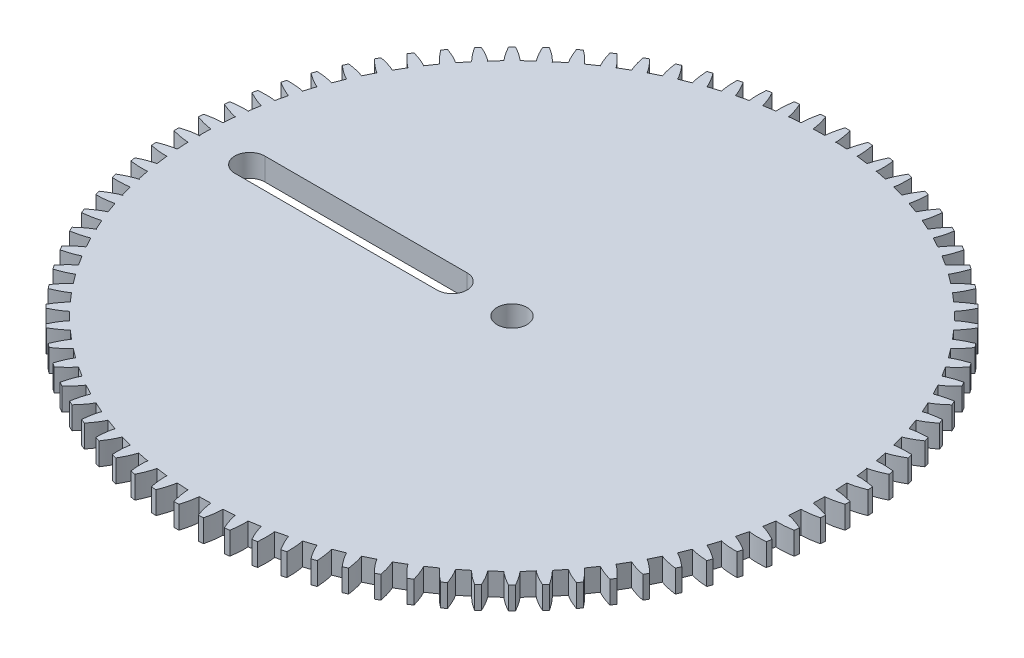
SolidWorks part; units mm, degrees
ref_plane "Front Plane" through (0, 0, 0) normal (0, 0, 1) x (1, 0, 0)
ref_plane "Top Plane" through (0, 0, 0) normal (0, 1, 0) x (1, 0, 0)
ref_plane "Right Plane" through (0, 0, 0) normal (1, 0, 0) x (0, 0, -1)
sketch "Sketch1" plane through (0, 0, 0) normal (0, 1, 0) x (1, 0, 0)
  line L0 (0, 0) -> (0, 20.8152) construction
  line L1 (0, 0) -> (-20.8152, 0) construction
  line L2 (0, 0) -> (-21.9963, -0.4018) construction
  line L3 (0, 0) -> (-20.8013, -0.7602) construction
  line L4 (0, 0) -> (-20.7596, -1.5194) construction
  circle A0 centre (0, 0) radius 21.5 construction
  circle A1 centre (0, 0) radius 20.8152 construction
  circle A2 centre (0, 0) radius 20.875 construction
  circle A3 centre (0, 0) radius 22 construction
  spline S0 degree 4 poles (-20.8152, 0) (-20.8518, 0) (-20.9546, -0.0038) (-21.1481, -0.0258) (-21.4608, -0.0826) (-21.8534, -0.1856) (-22.3513, -0.3531) (-22.9232, -0.5936) (-23.5332, -0.9024) (-24.1739, -1.2842) (-24.7904, -1.7051) (-25.3824, -2.1598) (-25.9498, -2.6446) (-26.6091, -3.2656) (-27.3591, -4.06) (-28.1717, -5.0485) (-29.0143, -6.2484) (-29.7821, -7.5292) (-30.4617, -8.8588) (-30.9809, -10.0577) (-31.3734, -11.1061) (-31.6662, -11.9916) (-31.88, -12.7065) (-32.1223, -13.6072) (-32.3314, -14.5163) (-32.4906, -15.3406) (-32.6098, -16.0771) (-32.6899, -16.631) (-32.7605, -17.1859) (-32.8196, -17.7428) (-32.8673, -18.2996) (-32.8995, -18.7666) (-32.9205, -19.1302) (-32.9416, -19.6109) (-32.9531, -19.9952) (-32.9652, -20.6867) (-32.958, -21.1945) (-32.9494, -21.7453) (-32.9362, -22.0017) (-32.9302, -22.1799) knots 0 0 0 0 0 0.005377 0.015084 0.028532 0.04661 0.064855 0.092111 0.119476 0.146842 0.174209 0.201575 0.228941 0.256307 0.307035 0.361767 0.4165 0.471232 0.525964 0.580697 0.608063 0.635429 0.662795 0.690161 0.744894 0.77226 0.785943 0.799626 0.826992 0.854358 0.868042 0.881725 0.895408 0.909091 0.931818 0.954545 0.977273 1 1 1 1 1 construction
  spline S1 degree 4 poles (-20.8152, 0) (-20.8518, 0) (-20.9546, -0.0038) (-21.1481, -0.0258) (-21.4608, -0.0826) (-21.8534, -0.1856) (-22.3513, -0.3531) (-22.9232, -0.5936) (-23.5332, -0.9024) (-24.1739, -1.2842) (-24.7904, -1.7051) (-25.3824, -2.1598) (-25.9498, -2.6446) (-26.6091, -3.2656) (-27.3591, -4.06) (-28.1717, -5.0485) (-29.0143, -6.2484) (-29.7821, -7.5292) (-30.4617, -8.8588) (-30.9809, -10.0577) (-31.3734, -11.1061) (-31.6662, -11.9916) (-31.88, -12.7065) (-32.1223, -13.6072) (-32.3314, -14.5163) (-32.4906, -15.3406) (-32.6098, -16.0771) (-32.6899, -16.631) (-32.7605, -17.1859) (-32.8196, -17.7428) (-32.8673, -18.2996) (-32.8995, -18.7666) (-32.9205, -19.1302) (-32.9341, -19.4396) (-32.9406, -19.6121) (-32.9434, -19.6968) knots 0 0 0 0 0 0.005377 0.015084 0.028532 0.04661 0.064855 0.092111 0.119476 0.146842 0.174209 0.201575 0.228941 0.256307 0.307035 0.361767 0.4165 0.471232 0.525964 0.580697 0.608063 0.635429 0.662795 0.690161 0.744894 0.77226 0.785943 0.799626 0.826992 0.854358 0.868042 0.881725 0.895408 0.909091 0.909091 0.909091 0.909091 0.909091
  dimension "D1" = 44
  dimension "D2" = 43
  dimension "D3" = 41.6303
  dimension "D4" = 41.75
  dimension "D5" = 20.8152
  dimension "D6" = 1.047
  dimension "D7" = 2.093
  dimension "D8" = 4.186
sketch "Sketch2" plane through (0, 0, 0) normal (0, 1, 0) x (1, 0, 0)
  line L0 (0, 0) -> (-21.9963, -0.4018) construction
  line L1 (0, 0) -> (-21.9963, -0.4018) construction
  line L2 (0, 0) -> (-20.8013, -0.7602) construction
  line L3 (0, 0) -> (-20.8152, 0) construction
  line L4 (0, 0) -> (-20.7596, -1.5194) construction
  line L5 (0, 0) -> (-20.8013, -0.7602) construction
  line L6 (0, 0) -> (-20.8152, 0) construction
  line L7 (0, 0) -> (-20.7596, -1.5194) construction
  line L8 (-20.875, 0) -> (-20.8611, -0.7624) construction
  line L9 (-20.8611, -0.7624) -> (-20.8193, -1.5238)
  line L10 (-20.8193, -1.5238) -> (-20.7596, -1.5194) construction
  line L11 (-20.8193, -1.5238) -> (-0.9973, -0.073)
  line L12 (-20.8152, 0) -> (-1, 0)
  circle A0 centre (0, 0) radius 20.875 construction
  circle A1 centre (0, 0) radius 20.8152 construction
  circle A2 centre (0, 0) radius 21.5 construction
  circle A3 centre (0, 0) radius 22 construction
  circle A4 centre (0, 0) radius 20.875 construction
  circle A5 centre (0, 0) radius 20.8152 construction
  circle A6 centre (0, 0) radius 21.5 construction
  circle A7 centre (0, 0) radius 22 construction
  arc A8 (-21.9927, -0.5657) -> (-21.9987, -0.2379) centre (0, 0) cw
  circle A11 centre (0, 0) radius 1 construction
  arc A12 (-1, 0) -> (-0.9973, -0.073) centre (0, 0) ccw
  spline S2 degree 4 poles (-20.8611, -0.7624) (-20.8685, -0.7621) (-20.9525, -0.7585) (-21.142, -0.7417) (-21.4268, -0.7001) (-21.701, -0.6414) (-21.8985, -0.5913) (-21.9927, -0.5657) knots 0.004428 0.004428 0.004428 0.004428 0.004428 0.005377 0.015084 0.028532 0.040915 0.040915 0.040915 0.040915 0.040915
  spline S3 degree 4 poles (-78.0062, -1999.0207) (-15.1603, -47.2526) (-16.4903, -1.0471) (-19.0617, 0.3537) (-21.4608, -0.0826) (-21.8534, -0.1856) (-22.3513, -0.3531) (-22.9232, -0.5936) (-23.5332, -0.9024) (-24.1739, -1.2842) (-24.7904, -1.7051) (-25.3824, -2.1598) (-25.9498, -2.6446) (-26.6091, -3.2656) (-27.3591, -4.06) (-28.1717, -5.0485) (-29.0143, -6.2484) (-29.7821, -7.5292) (-30.4617, -8.8588) (-30.9809, -10.0577) (-31.3734, -11.1061) (-31.6662, -11.9916) (-31.88, -12.7065) (-32.1223, -13.6072) (-32.3314, -14.5163) (-32.4906, -15.3406) (-32.6098, -16.0771) (-32.6899, -16.631) (-32.7605, -17.1859) (-32.8196, -17.7428) (-32.8673, -18.2996) (-32.8995, -18.7666) (-33.0213, -20.8767) (-33.0211, -24.9047) (-30.9414, 29.1408) (-98.6457, -2018.4397) knots -0.310976 -0.310976 -0.310976 -0.310976 -0.310976 0.005377 0.015084 0.028532 0.04661 0.064855 0.092111 0.119476 0.146842 0.174209 0.201575 0.228941 0.256307 0.307035 0.361767 0.4165 0.471232 0.525964 0.580697 0.608063 0.635429 0.662795 0.690161 0.744894 0.77226 0.785943 0.799626 0.826992 0.854358 0.868042 0.881725 0.895408 1.171971 1.171971 1.171971 1.171971 1.171971 only from (-20.8152, 0) to (-32.9434, -19.6968) construction
  spline S4 degree 4 poles (-20.8152, 0) (-20.8518, 0) (-20.9546, -0.0038) (-21.1481, -0.0258) (-21.4462, -0.08) (-21.7042, -0.1465) (-21.8957, -0.2044) (-21.9987, -0.2379) knots 0 0 0 0 0 0.005377 0.015084 0.028532 0.04443 0.04443 0.04443 0.04443 0.04443
  point P18 (-20.868, -0.3812)
  point P24 (-20.8193, -1.5238)
  dimension "D2" = 2
extrude "Boss-Extrude1" add sketch "Sketch2" along normal blind 1.5
pattern_circular "CirPattern1" count 86 over 360 of "Boss-Extrude1"
sketch "Sketch3" plane through (0, 1.5, 0) normal (0, 1, 0) x (1, 0, 0)
  line L0 (-4, 0) -> (-17.5, 0) construction
  line L1 (-4, -1) -> (-17.5, -1)
  line L2 (-4, 1) -> (-17.5, 1)
  arc A0 (-4, -1) -> (-4, 1) centre (-4, 0) ccw
  arc A1 (-17.5, 1) -> (-17.5, -1) centre (-17.5, 0) ccw
  point P3 (-10.75, 0)
  dimension "D1" = 1
  dimension "D2" = 4
  dimension "D3" = 13.5
extrude "Cut-Extrude1" cut sketch "Sketch3" against normal up to surface (1.5 mm away)
equation "\"Module\"= .5"
equation "\"Number of Teeth\"= 86"
equation "\"Pressure Angle\"= 14.5deg"
equation "\"Pitch Diameter\"= \"Number of Teeth\" * \"Module\""
equation "\"Circular Pitch\"= pi * \"Module\""
equation "\"Addendum\"= \"Module\""
equation "\"Dedendum\"= 1.25 * \"Module\""
equation "\"Base Diameter\"= \"Pitch Diameter\" * cos ( \"Pressure Angle\" )"
equation "\"Base Radius\"= \"Base Diameter\" / 2"
equation "\"Width\"= 1.5mm"
equation "\"Outside Diameter\"= \"Pitch Diameter\" + 2 * \"Addendum\""
equation "\"D1@Sketch1\"=\"Outside Diameter\""
equation "\"D3@Sketch1\"=\"Base Diameter\""
equation "\"Root Diameter\"= \"Pitch Diameter\" - 2 * \"Dedendum\""
equation "\"D4@Sketch1\"=\"Root Diameter\""
equation "\"Tooth Angle\"= 360 / \"Number of Teeth\""
equation "\"D6@Sketch1\"=\"Tooth Angle\"/4"
equation "\"D7@Sketch1\"=\"Tooth Angle\"/2"
equation "\"D8@Sketch1\"=\"Tooth Angle\""
equation "\"D2@Sketch1\" = \"Pitch Diameter\""
equation "\"Shaft Diameter\"= 2"
equation "\"D1@CirPattern1\" = \"Number of Teeth\""
equation "\"D2@Sketch2\"  = \"Shaft Diameter\""
equation "\"D1@Boss-Extrude1\" = \"Width\""
